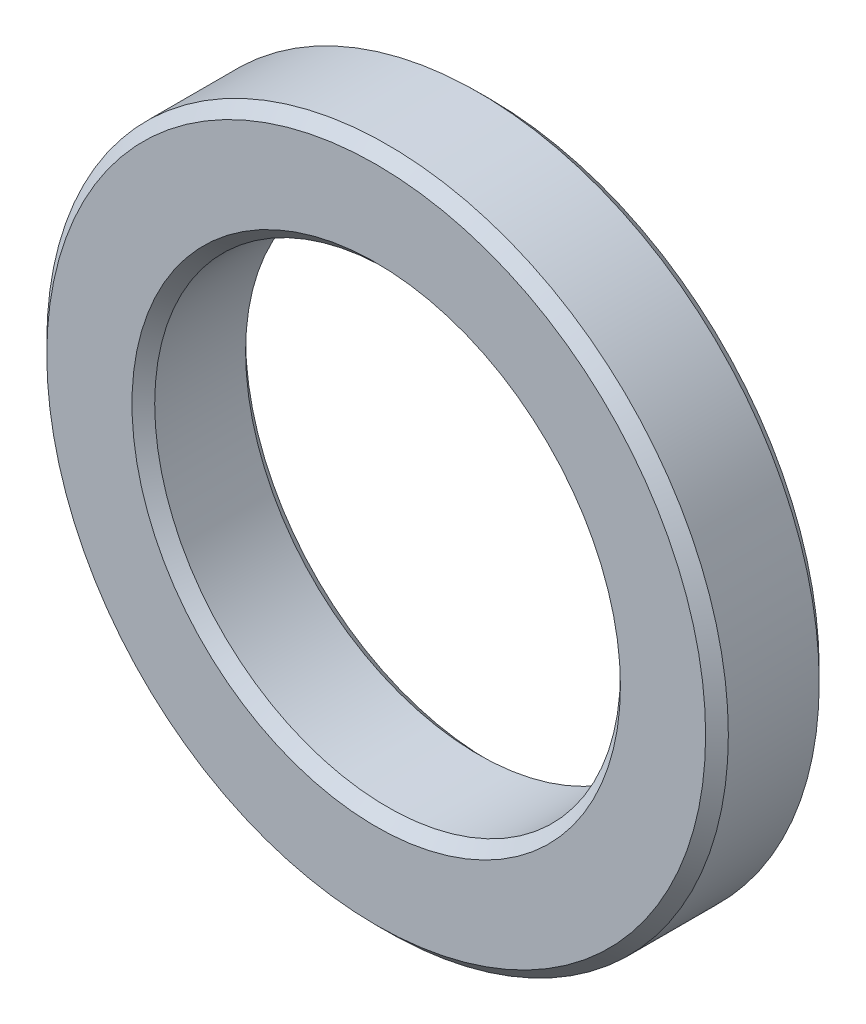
SolidWorks part; units mm, degrees
ref_plane "Front Plane" through (0, 0, 0) normal (0, 0, 1) x (1, 0, 0)
ref_plane "Top Plane" through (0, 0, 0) normal (0, 1, 0) x (1, 0, 0)
ref_plane "Right Plane" through (0, 0, 0) normal (1, 0, 0) x (0, 0, -1)
sketch "Sketch1" plane through (0, 0, 0) normal (0, 0, 1) x (1, 0, 0)
  circle A0 centre (0, 0) radius 6
  circle A1 centre (0, 0) radius 4.1
  dimension "D1" = 12
  dimension "D2" = 8.2
extrude "Boss-Extrude2" add sketch "Sketch1" along normal mid plane 2
chamfer "Chamfer3" distance 0.2 angle 45 4 edges at (6, 0, 1) (6, 0, -1) (4.1, 0, -1) (4.1, 0, 1)
